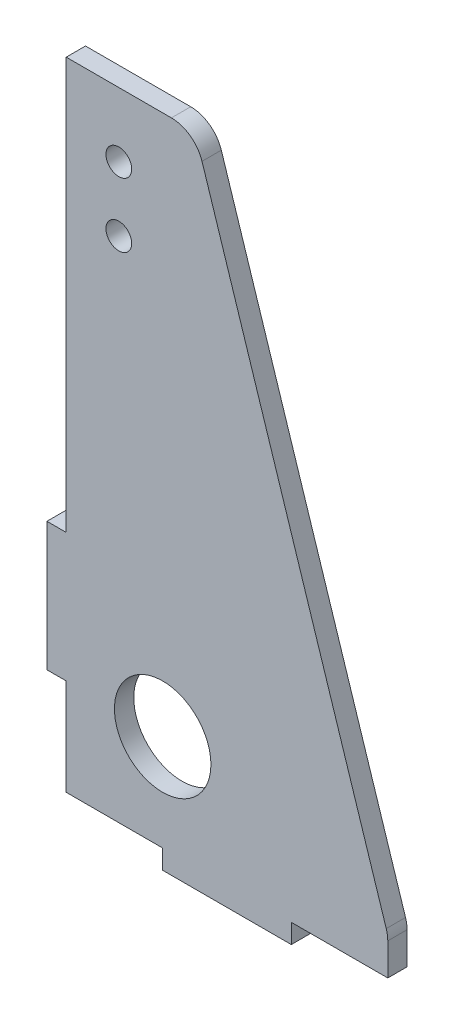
SolidWorks part; units mm, degrees
ref_plane "Plan de face" through (0, 0, 0) normal (0, 0, 1) x (1, 0, 0)
ref_plane "Plan de dessus" through (0, 0, 0) normal (0, 1, 0) x (1, 0, 0)
ref_plane "Plan de droite" through (0, 0, 0) normal (1, 0, 0) x (0, 0, -1)
sketch "Esquisse1" plane through (0, 0, 0) normal (0, 0, 1) x (1, 0, 0)
  line L0 (0, 0) -> (0, 15)
  line L1 (0, 15) -> (-3, 15)
  line L2 (-3, 15) -> (-3, 35)
  line L3 (-3, 35) -> (0, 35)
  line L4 (0, 35) -> (0, 99)
  line L6 (50, 0) -> (35, 0)
  line L7 (0, 99) -> (16.3566, 99)
  line L8 (21.1162, 95.5318) -> (49.7596, 6.5318)
  line L9 (50, 5) -> (50, 0)
  line L10 (8.1783, 99) -> (8.1783, 79) construction
  line L11 (15, 0) -> (15, -3)
  line L12 (15, -3) -> (35, -3)
  line L13 (35, -3) -> (35, 0)
  line L14 (15, 0) -> (0, 0)
  arc A0 (49.7596, 6.5318) -> (50, 5) centre (45, 5) cw
  arc A1 (16.3566, 99) -> (21.1162, 95.5318) centre (16.3566, 94) cw
  circle A2 centre (8.1783, 89) radius 2
  circle A3 centre (8.1783, 79) radius 2
  circle A4 centre (15, 15) radius 7.5
  point P14 (20, 99)
  dimension "D6" = 5
  dimension "D9" = 5
  dimension "D10" = 4
  dimension "D16" = 15
  dimension "D17" = 15
  dimension "D1" = 15
  dimension "D2" = 64
  dimension "D3" = 20
  dimension "D4" = 3
  dimension "D5" = 50
  dimension "D7" = 20
  dimension "D8" = 5
  dimension "D11" = 10
  dimension "D12" = 10
  dimension "D13" = 15
  dimension "D14" = 15
  dimension "D15" = 3
extrude "Boss.-Extru.1" add sketch "Esquisse1" along normal blind 3
